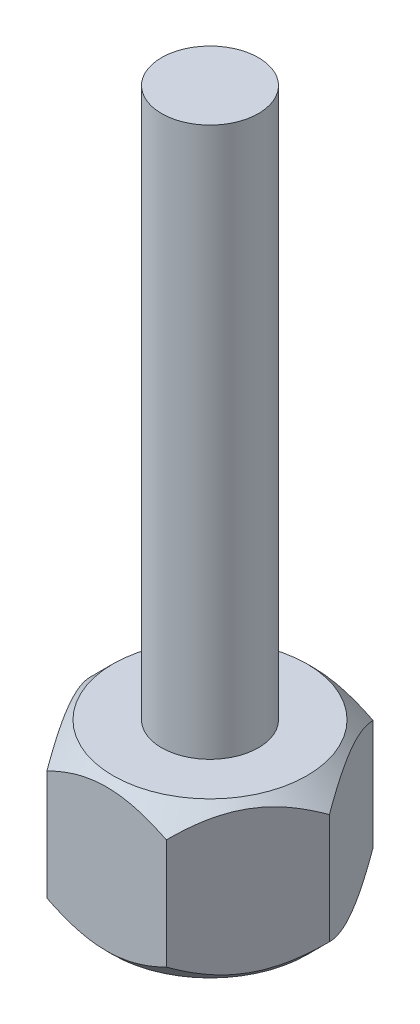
SolidWorks part; units mm, degrees
ref_plane "Front Plane" through (0, 0, 0) normal (0, 0, 1) x (1, 0, 0)
ref_plane "Top Plane" through (0, 0, 0) normal (0, 1, 0) x (1, 0, 0)
ref_plane "Right Plane" through (0, 0, 0) normal (1, 0, 0) x (0, 0, -1)
sketch "Sketch1" plane through (0, 0, 0) normal (0, 1, 0) x (1, 0, 0)
  line L1 (4.6188, 0) -> (2.3094, 4)
  line L2 (2.3094, 4) -> (-2.3094, 4)
  line L3 (-2.3094, 4) -> (-4.6188, 0)
  line L4 (-4.6188, 0) -> (-2.3094, -4)
  line L5 (-2.3094, -4) -> (2.3094, -4)
  line L6 (2.3094, -4) -> (4.6188, 0)
  circle A0 centre (0, 0) radius 4 construction
  dimension "D1" = 8
extrude "Boss-Extrude1" add sketch "Sketch1" along normal mid plane 6
sketch "Sketch2" plane through (0, 3, 0) normal (0, 1, 0) x (1, 0, 0)
  circle A0 centre (0, 0) radius 3.75
  dimension "D1" = 7.5
extrude "Cut-Extrude1" cut sketch "Sketch2" against normal blind 6 draft 45 flip side to cut
sketch "Sketch3" plane through (0, -3, 0) normal (0, -1, 0) x (1, 0, 0)
  circle A0 centre (0, 0) radius 3.75
  dimension "D1" = 7.5
extrude "Cut-Extrude2" cut sketch "Sketch3" against normal blind 6 draft 45 flip side to cut
sketch "Sketch4" plane through (0, 3, 0) normal (0, 1, 0) x (1, 0, 0)
  circle A0 centre (0, 0) radius 1.875
  dimension "D1" = 3.75
extrude "Boss-Extrude2" add sketch "Sketch4" along normal blind 21.25
